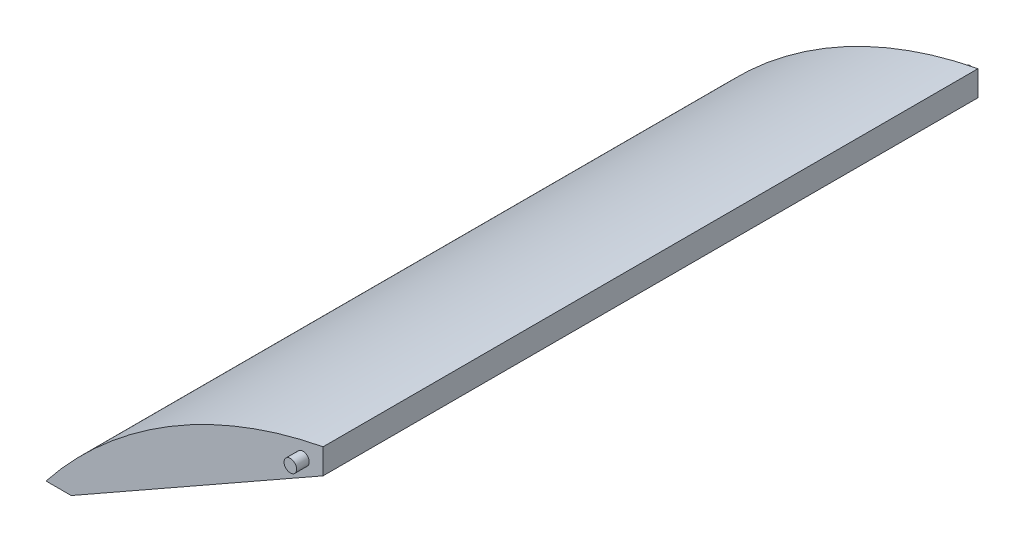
SolidWorks part; units mm, degrees
ref_plane "Front Plane" through (0, 0, 0) normal (0, 0, 1) x (1, 0, 0)
ref_plane "Top Plane" through (0, 0, 0) normal (0, 1, 0) x (1, 0, 0)
ref_plane "Right Plane" through (0, 0, 0) normal (1, 0, 0) x (0, 0, -1)
sketch "Sketch4" plane through (0, 0, 0) normal (0, 0, 1) x (1, 0, 0)
  line L0 (0, 0) -> (145, 0)
  line L1 (145, 0) -> (145, 70.11)
  line L2 (145, 0) -> (145, -114.8879) construction
  arc A0 (145, 70.11) -> (0, 0) centre (145, -114.8879) ccw
  dimension "D1" = 145
  dimension "D2" = 70.11
extrude "Boss-Extrude3" add sketch "Sketch4" along normal blind 260
sketch "Sketch5" plane through (0, 0, 260) normal (0, 0, 1) x (1, 0, 0)
  line L0 (0, 0) -> (145, 0) construction
  line L1 (145, 70.11) -> (110, 70.11)
  line L2 (145, 70.11) -> (145, 0)
  line L3 (145, 0) -> (110, 0)
  line L4 (110, 70.11) -> (110, 0)
  dimension "D1" = 35
extrude "Cut-Extrude1" cut sketch "Sketch5" against normal blind 260
sketch "Sketch6" plane through (0, 0, 260) normal (0, 0, 1) x (1, 0, 0)
  line L0 (110, 0) -> (10, 0)
  line L1 (0, 0) -> (110, 0) construction
  line L2 (110, 0) -> (110, 56.769)
  line L3 (110, 66.769) -> (110, 0) construction
  line L4 (10, 0) -> (110, 56.769)
  dimension "D1" = 10
  dimension "D2" = 10
extrude "Cut-Extrude2" cut sketch "Sketch6" against normal blind 260
sketch "Sketch8" plane through (0, 0, 260) normal (0, 0, 1) x (1, 0, 0)
  line L0 (110, 66.769) -> (110, 58.769) construction
  line L1 (110, 66.769) -> (110, 56.769) construction
  line L2 (110, 58.769) -> (102, 58.769) construction
  circle A0 centre (102, 58.769) radius 2.5
  dimension "D3" = 5
  dimension "D1" = 8
  dimension "D2" = 8
extrude "Boss-Extrude4" add sketch "Sketch8" along normal blind 5
ref_plane "Plane2" through (0, 0, 130) normal (0, 0, 1) x (1, 0, 0)
mirror "Mirror2" about plane through (0, 0, 130) normal (0, 0, 1) of "Boss-Extrude4"
